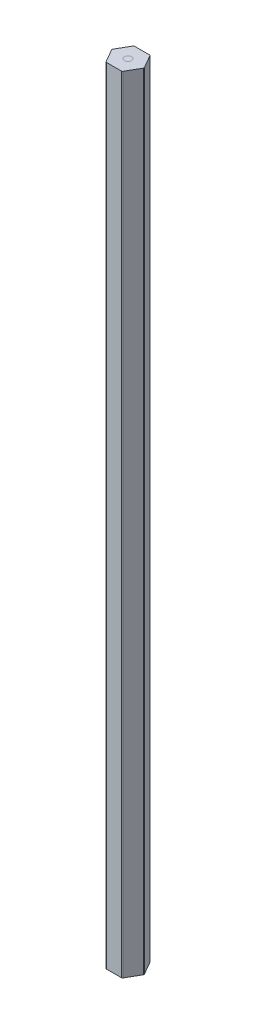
SolidWorks part; units mm, degrees
ref_plane "Front Plane" through (0, 0, 0) normal (0, 0, 1) x (1, 0, 0)
ref_plane "Top Plane" through (0, 0, 0) normal (0, 1, 0) x (1, 0, 0)
ref_plane "Right Plane" through (0, 0, 0) normal (1, 0, 0) x (0, 0, -1)
sketch "Sketch2" plane through (0, 0, 0) normal (0, 1, 0) x (1, 0, 0)
  line L7 (-1.9064, 3.048) -> (-3.5929, 0.127)
  line L8 (-1.6864, 3.175) -> (1.6864, 3.175)
  line L11 (-1.6864, -3.175) -> (1.6864, -3.175)
  line L12 (-1.9064, -3.048) -> (-3.5929, -0.127)
  line L15 (3.5929, 0.127) -> (1.9064, 3.048)
  line L17 (3.5929, -0.127) -> (1.9064, -3.048)
  circle A0 centre (0, 0) radius 0.7937
  arc A1 (-1.9064, 3.048) -> (-1.6864, 3.175) centre (-1.6864, 2.921) cw
  arc A2 (1.9064, 3.048) -> (1.6864, 3.175) centre (1.6864, 2.921) ccw
  arc A3 (3.5929, -0.127) -> (3.5929, 0.127) centre (3.3729, 0) ccw
  arc A4 (1.6864, -3.175) -> (1.9064, -3.048) centre (1.6864, -2.921) ccw
  arc A5 (-1.9064, -3.048) -> (-1.6864, -3.175) centre (-1.6864, -2.921) ccw
  arc A6 (-3.5929, 0.127) -> (-3.5929, -0.127) centre (-3.3729, 0) ccw
  dimension "D1" = 0.254
extrude "Extrude1" add sketch "Sketch2" along normal blind 177.8
sketch "Sketch3" plane through (0, 0, 0) normal (0, -1, 0) x (1, 0, 0)
  circle A0 centre (0, 0) radius 0.7937
extrude "Extrude2" add sketch "Sketch3" against normal blind 177.8 separate body
sketch "Sketch5" plane through (0, 0, 0) normal (1, 0, 0) x (0, 0, -1)
  line L0 (0, -3.175) -> (4.545, -3.175)
  line L1 (4.545, 15.6548) -> (0, 0)
  line L2 (4.545, -3.175) -> (4.545, 15.6548)
  line L5 (0, 0) -> (0, -3.175)
revolve "Cut-Revolve3" [suppressed] cut sketch "Sketch5" angle 360 about L5
